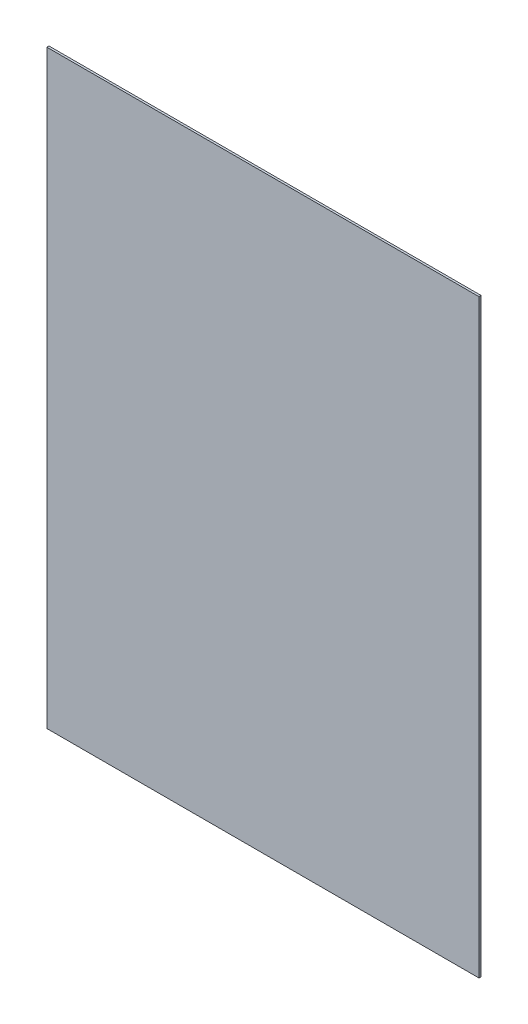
SolidWorks part; units mm, degrees
ref_plane "Piano frontale" through (0, 0, 0) normal (0, 0, 1) x (1, 0, 0)
ref_plane "Piano superiore" through (0, 0, 0) normal (0, 1, 0) x (1, 0, 0)
ref_plane "Piano destro" through (0, 0, 0) normal (1, 0, 0) x (0, 0, -1)
sketch "Schizzo1" plane through (0, 0, 0) normal (0, 0, 1) x (1, 0, 0)
  line L1 (-410, -560) -> (410, -560)
  line L2 (-410, -560) -> (-410, 560)
  line L3 (-410, 560) -> (410, 560)
  line L4 (410, -560) -> (410, 560)
  line L5 (-410, -560) -> (410, 560) construction
  line L6 (-410, 560) -> (410, -560) construction
  point P0 (0, 0)
  dimension "D1" = 820
  dimension "D2" = 1120
extrude "Estrusione-Estrusione1" add sketch "Schizzo1" along normal blind 4
